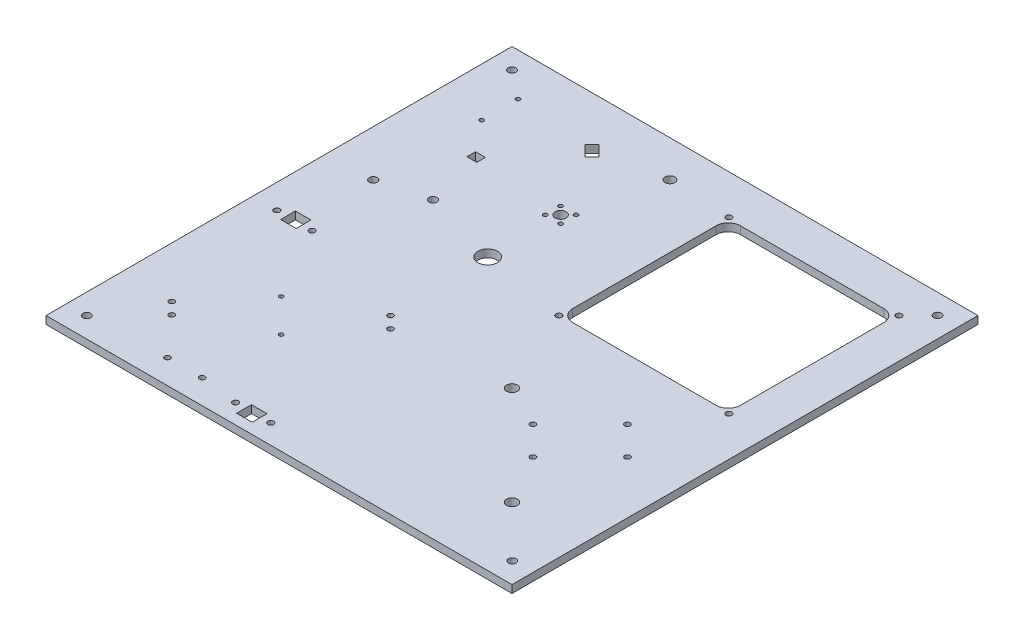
SolidWorks part; units mm, degrees
ref_plane "Front Plane" through (0, 0, 0) normal (0, 0, 1) x (1, 0, 0)
ref_plane "Top Plane" through (0, 0, 0) normal (0, 1, 0) x (1, 0, 0)
ref_plane "Right Plane" through (0, 0, 0) normal (1, 0, 0) x (0, 0, -1)
sketch "Sketch2" plane through (0, 0, 0) normal (0, 1, 0) x (1, 0, 0)
  line L1 (-191.77, -191.77) -> (191.77, -191.77)
  line L2 (-191.77, -191.77) -> (-191.77, 191.77)
  line L3 (-191.77, 191.77) -> (191.77, 191.77)
  line L4 (191.77, -191.77) -> (191.77, 191.77)
  line L5 (-191.77, -191.77) -> (191.77, 191.77) construction
  line L6 (-191.77, 191.77) -> (191.77, -191.77) construction
  point P0 (0, 0)
  dimension "D1" = 383.54
  dimension "D2" = 383.54
extrude "Boss-Extrude2" add sketch "Sketch2" along normal blind 6.35
hole_wizard "M6 Clearance Hole3" positions "Sketch3" profile "Sketch4" hole size "M6" standard "ANSI Metric"
sketch "Sketch3" plane through (0, 6.35, 0) normal (0, 1, 0) x (1, 0, 0)
  line L0 (191.77, 191.77) -> (-191.77, 191.77) construction
  line L1 (191.77, -191.77) -> (191.77, 191.77) construction
  point P0 (51.77, 151.77)
  point P2 (151.77, 151.77)
  point P4 (101.77, 101.77)
  point P6 (51.77, 51.77)
  point P8 (76.77, 76.77)
  point P10 (101.77, 51.77)
  dimension "D1" = 40
  dimension "D2" = 140
  dimension "D3" = 40
  dimension "D4" = 100
  dimension "D5" = 50
  dimension "D6" = 50
  dimension "D7" = 50
  dimension "D8" = 50
  dimension "D9" = 50
  dimension "D10" = 25
  dimension "D11" = 25
  dimension "D12" = 140
sketch "Sketch4" plane through (51.77, 6.35, -151.77) normal (1, 0, 0) x (0, 0, 1)
  line L0 (0, 0) -> (0, 6.35)
  line L1 (0, 6.35) -> (3.3, 6.35)
  line L2 (3.3, 6.35) -> (3.3, 0)
  line L5 (3.3, 0) -> (0, 0)
  line L11 (0, -6.35) -> (0, 107.95) construction
  dimension "Thru Hole Dia." = 6.6
  dimension "Thru Hole Depth" = 6.35
hole_wizard "M8 Clearance Hole2" positions "Sketch5" profile "Sketch6" hole size "M8" standard "ANSI Metric"
sketch "Sketch5" plane through (0, 6.35, 0) normal (0, 1, 0) x (1, 0, 0)
  circle A1 centre (151.77, 151.77) radius 3.3 construction
  circle A2 centre (51.77, 151.77) radius 3.3 construction
  circle A3 centre (76.77, 76.77) radius 3.3 construction
  circle A4 centre (101.77, 101.77) radius 3.3 construction
  point P0 (126.77, 126.77)
  point P2 (26.77, 126.77)
  point P4 (151.77, 101.77)
  point P6 (126.77, 26.77)
  point P8 (76.77, 26.77)
  point P10 (26.77, 76.77)
  dimension "D11" = 50
  dimension "D1" = 25
  dimension "D2" = 25
  dimension "D3" = 75
  dimension "D4" = 50
  dimension "D5" = 50
  dimension "D6" = 50
  dimension "D7" = 75
  dimension "D8" = 50
  dimension "D9" = 50
  dimension "D10" = 50
  dimension "D12" = 50
sketch "Sketch6" plane through (126.77, 6.35, -126.77) normal (1, 0, 0) x (0, 0, 1)
  line L0 (0, 0) -> (0, 6.35)
  line L1 (0, 6.35) -> (5, 6.35)
  line L2 (5, 6.35) -> (5, 0)
  line L5 (5, 0) -> (0, 0)
  line L11 (0, -6.35) -> (0, 107.95) construction
  dimension "Thru Hole Dia." = 10
  dimension "Thru Hole Depth" = 6.35
hole_wizard "1/4 (0.2500) Dowel Hole1" positions "Sketch9" profile "Sketch10" hole size "1/4" standard "ANSI Inch"
sketch "Sketch9" plane through (0, 6.35, 0) normal (0, 1, 0) x (1, 0, 0)
  line L1 (-191.77, -191.77) -> (191.77, -191.77) construction
  line L10 (191.77, -191.77) -> (191.77, 191.77) construction
  line L11 (191.77, 191.77) -> (-191.77, 191.77) construction
  point P0 (-175, -175)
  point P2 (-175, 175)
  point P4 (175, 175.23)
  point P6 (175, -174.77)
  dimension "D1" = 350
  dimension "D2" = 350
  dimension "D3" = 350
  dimension "D4" = 350
  dimension "D5" = 16.77
  dimension "D6" = 16.77
  dimension "D7" = 16.77
sketch "Sketch10" plane through (-175, 6.35, 175) normal (1, 0, 0) x (0, 0, 1)
  line L0 (0, 0) -> (0, 6.35)
  line L1 (0, 6.35) -> (3.175, 6.35)
  line L2 (3.175, 6.35) -> (3.175, 0)
  line L5 (3.175, 0) -> (0, 0)
  line L11 (0, -6.35) -> (0, 107.95) construction
  dimension "Thru Hole Dia." = 6.35
  dimension "Thru Hole Depth" = 6.35
hole_wizard "M4 Clearance Hole3" positions "Sketch11" profile "Sketch12" hole size "M4" standard "ANSI Metric"
sketch "Sketch11" plane through (0, 6.35, 0) normal (0, 1, 0) x (1, 0, 0)
  line L0 (-191.77, -191.77) -> (191.77, -191.77) construction
  line L1 (-191.77, 191.77) -> (-191.77, -191.77) construction
  point P0 (-51.77, -175.77)
  point P2 (-22.77, -175.77)
  point P24 (-171.77, -21.77)
  point P26 (-142.77, -21.77)
  dimension "D1" = 29
  dimension "D2" = 16
  dimension "D7" = 29
  dimension "D8" = 20
  dimension "D9" = 170
  dimension "D18" = 140
sketch "Sketch12" plane through (-51.77, 6.35, 175.77) normal (1, 0, 0) x (0, 0, 1)
  line L0 (0, 0) -> (0, 10.4321)
  line L1 (0, 10.4321) -> (2.4, 8.99)
  line L2 (2.4, 8.99) -> (2.4, 0)
  line L5 (2.4, 0) -> (0, 0)
  line L10 (0, 10.4321) -> (-2.4, 8.99) construction
  line L11 (0, -6.35) -> (0, 107.95) construction
  dimension "Hole Dia." = 4.8
  dimension "Hole Depth" = 8.99
  dimension "Drill Angle" = 118
hole_wizard "M8 Clearance Hole1" positions "Sketch15" profile "Sketch16" hole size "M8" standard "ANSI Metric"
sketch "Sketch15" plane through (0, 6.35, 0) normal (0, 1, 0) x (1, 0, 0)
  line L0 (191.77, -191.77) -> (191.77, 191.77) construction
  line L1 (-191.77, -191.77) -> (191.77, -191.77) construction
  line L4 (133.0873, -133.0873) -> (51.77, -51.77) construction
  line L6 (-191.77, -191.77) -> (191.77, -191.77) construction
  point P0 (51.77, -51.77)
  point P9 (133.0873, -133.0873)
  dimension "D1" = 140
  dimension "D2" = 140
  dimension "D3" = 115
  dimension "D4" = 45
sketch "Sketch16" plane through (51.77, 6.35, 51.77) normal (1, 0, 0) x (0, 0, 1)
  line L0 (0, 0) -> (0, 11.6939)
  line L1 (0, 11.6939) -> (4.5, 8.99)
  line L2 (4.5, 8.99) -> (4.5, 0)
  line L5 (4.5, 0) -> (0, 0)
  line L10 (0, 11.6939) -> (-4.5, 8.99) construction
  line L11 (0, -6.35) -> (0, 107.95) construction
  dimension "Hole Dia." = 9
  dimension "Hole Depth" = 8.99
  dimension "Drill Angle" = 118
hole_wizard "M3 Clearance Hole1" positions "Sketch17" profile "Sketch18" hole size "M3" standard "ANSI Metric"
sketch "Sketch17" plane through (0, 6.35, 0) normal (0, 1, 0) x (1, 0, 0)
  line L0 (-191.77, 191.77) -> (-191.77, -191.77) construction
  line L1 (191.77, 191.77) -> (-191.77, 191.77) construction
  point P0 (-151.77, 156.77)
  point P2 (-151.77, 126.77)
  point P4 (-58.09, 85.44)
  point P6 (-45.44, 85.44)
  point P8 (-45.44, 98.09)
  point P10 (-58.09, 98.09)
  dimension "D1" = 30
  dimension "D2" = 12.65
  dimension "D3" = 12.65
  dimension "D4" = 12.65
  dimension "D5" = 12.65
  dimension "D6" = 17.8898
  dimension "D7" = 40
  dimension "D8" = 35
  dimension "D9" = 40
  dimension "D10" = 133.68
  dimension "D11" = 93.68
sketch "Sketch18" plane through (-151.77, 6.35, -156.77) normal (1, 0, 0) x (0, 0, 1)
  line L0 (0, 0) -> (0, 10.0115)
  line L1 (0, 10.0115) -> (1.7, 8.99)
  line L2 (1.7, 8.99) -> (1.7, 0)
  line L5 (1.7, 0) -> (0, 0)
  line L10 (0, 10.0115) -> (-1.7, 8.99) construction
  line L11 (0, -6.35) -> (0, 107.95) construction
  dimension "Hole Dia." = 3.4
  dimension "Hole Depth" = 8.99
  dimension "Drill Angle" = 118
sketch "Sketch19" plane through (0, 6.35, 0) normal (0, 1, 0) x (1, 0, 0)
  line L0 (-91.77, 151.77) -> (-83.1857, 143.1857)
  line L1 (-83.1857, 143.1857) -> (-77.444, 148.9274)
  line L2 (-77.444, 148.9274) -> (-86.0283, 157.5117)
  line L3 (-86.0283, 157.5117) -> (-91.77, 151.77)
  line L4 (-131.77, 101.77) -> (-131.77, 94.65)
  line L5 (-131.77, 94.65) -> (-123.65, 94.65)
  line L6 (-123.65, 94.65) -> (-123.65, 101.77)
  line L7 (-123.65, 101.77) -> (-131.77, 101.77)
  line L8 (191.77, 191.77) -> (-191.77, 191.77) construction
  line L9 (-191.77, 191.77) -> (-191.77, -191.77) construction
  line L10 (191.77, 191.77) -> (-191.77, 191.77) construction
  circle A0 centre (-51.77, 31.77) radius 8.1
  circle A1 centre (-31.77, 161.77) radius 4.06
  circle A2 centre (-51.77, 91.77) radius 4.5
  dimension "D1" = 7.12
  dimension "D13" = 100
  dimension "D2" = 8.12
  dimension "D3" = 8.12
  dimension "D4" = 12.14
  dimension "D5" = 40
  dimension "D6" = 100
  dimension "D7" = 90
  dimension "D8" = 60
  dimension "D9" = 140
  dimension "D10" = 160
  dimension "D11" = 30
  dimension "D12" = 160
  dimension "D14" = 140
  dimension "D15" = 45
extrude "Cut-Extrude1" cut sketch "Sketch19" against normal through all
sketch "Sketch20" plane through (0, 6.35, 0) normal (0, 1, 0) x (1, 0, 0)
  circle A0 centre (151.77, 151.77) radius 3.3 construction
  point P0 (159.27, 159.27)
  point P1 (159.27, 19.27)
  point P2 (19.27, 19.27)
  point P3 (19.27, 159.27)
  dimension "D3" = 140
  dimension "D1" = 7.5
  dimension "D2" = 7.5
  dimension "D4" = 140
hole_wizard "M4 Clearance Hole1" positions "Sketch21" profile "Sketch22" hole size "M4" standard "ANSI Metric"
sketch "Sketch21" plane through (0, 6.35, 0) normal (0, 1, 0) x (1, 0, 0)
  line L0 (159.27, 159.27) -> (19.27, 19.27) construction
  line L2 (19.27, 159.27) -> (159.27, 19.27) construction
  point P18 (159.27, 19.27)
  point P20 (19.27, 19.27)
  point P22 (19.27, 159.27)
  point P24 (159.27, 159.27)
  point P36 (89.27, 89.27)
  point P39 (89.27, 89.27)
  dimension "D3" = 140
  dimension "D4" = 140
  dimension "D5" = 140
  dimension "D6" = 140
sketch "Sketch22" plane through (159.27, 6.35, -19.27) normal (1, 0, 0) x (0, 0, 1)
  line L0 (0, 0) -> (0, 6.35)
  line L1 (0, 6.35) -> (2.4, 6.35)
  line L2 (2.4, 6.35) -> (2.4, 0)
  line L5 (2.4, 0) -> (0, 0)
  line L11 (0, -6.35) -> (0, 107.95) construction
  dimension "Thru Hole Dia." = 4.8
  dimension "Thru Hole Depth" = 6.35
sketch "Sketch23" plane through (0, 6.35, 0) normal (0, 1, 0) x (1, 0, 0)
  line L1 (30, 20) -> (148, 20)
  line L2 (20, 30) -> (20, 148)
  line L3 (30, 158) -> (148, 158)
  line L4 (158, 30) -> (158, 148)
  line L6 (-55, 0) -> (55, 0) construction
  line L8 (0, -55) -> (0, 55) construction
  arc A0 (20, 148) -> (30, 158) centre (30, 148) cw
  arc A1 (30, 20) -> (20, 30) centre (30, 30) cw
  arc A2 (158, 30) -> (148, 20) centre (148, 30) cw
  arc A3 (148, 158) -> (158, 148) centre (148, 148) cw
  point P10 (20, 158)
  point P15 (158, 20)
  point P18 (158, 158)
  dimension "D5" = 10
  dimension "D6" = 10
  dimension "D7" = 10
  dimension "D8" = 10
  dimension "D1" = 138
  dimension "D2" = 138
  dimension "D3" = 20
  dimension "D4" = 20
extrude "Cut-Extrude2" cut sketch "Sketch23" against normal through all
sketch "Sketch24" plane through (0, 0, 0) normal (0, -1, 0) x (1, 0, 0)
  line L0 (148.3345, 53.3345) -> (125, 30) construction
  line L1 (125, 30) -> (86.1091, 68.8909) construction
  line L2 (86.1091, 68.8909) -> (109.4437, 92.2254) construction
  line L3 (109.4437, 92.2254) -> (148.3345, 53.3345) construction
  line L4 (0, 0) -> (191.77, 0) construction
  line L5 (191.77, 191.77) -> (191.77, -191.77) construction
  point P0 (148.3345, 53.3345)
  point P1 (125, 30)
  point P2 (109.4437, 92.2254)
  point P3 (86.1091, 68.8909)
  dimension "D1" = 33
  dimension "D2" = 55
  dimension "D3" = 30
  dimension "D4" = 45
  dimension "D5" = 125
hole_wizard "M4 Clearance Hole2" positions "Sketch25" profile "Sketch26" hole size "M4" standard "ANSI Metric"
sketch "Sketch25" plane through (0, 0, 0) normal (0, -1, 0) x (-1, 0, 0)
  point P0 (-148.3345, -53.3345)
  point P3 (-125, -30)
  point P6 (-109.4437, -92.2254)
  point P9 (-86.1091, -68.8909)
sketch "Sketch26" plane through (148.3345, 0, 53.3345) normal (1, 0, 0) x (0, 0, -1)
  line L0 (0, 0) -> (0, 10.3419)
  line L1 (0, 10.3419) -> (2.25, 8.99)
  line L2 (2.25, 8.99) -> (2.25, 0)
  line L5 (2.25, 0) -> (0, 0)
  line L10 (0, 10.3419) -> (-2.25, 8.99) construction
  line L11 (0, -6.35) -> (0, 107.95) construction
  dimension "Hole Dia." = 4.5
  dimension "Hole Depth" = 8.99
  dimension "Drill Angle" = 118
hole_wizard "M6 Clearance Hole5" positions "Sketch27" profile "Sketch28" hole size "M6" standard "ANSI Metric"
sketch "Sketch27" plane through (0, 6.35, 0) normal (0, 1, 0) x (1, 0, 0)
  line L0 (-153.8302, 39.5955) -> (-115, 50) construction
  line L1 (191.77, 191.77) -> (-191.77, 191.77) construction
  point P0 (-115, 50)
  point P2 (-153.8302, 39.5955)
  dimension "D1" = 115
  dimension "D2" = 40.2
  dimension "D3" = 50
  dimension "D4" = 15
sketch "Sketch28" plane through (-115, 6.35, -50) normal (1, 0, 0) x (0, 0, 1)
  line L0 (0, 0) -> (0, 10.9728)
  line L1 (0, 10.9728) -> (3.3, 8.99)
  line L2 (3.3, 8.99) -> (3.3, 0)
  line L5 (3.3, 0) -> (0, 0)
  line L10 (0, 10.9728) -> (-3.3, 8.99) construction
  line L11 (0, -6.35) -> (0, 107.95) construction
  dimension "Hole Dia." = 6.6
  dimension "Hole Depth" = 8.99
  dimension "Drill Angle" = 118
sketch "Sketch29" plane through (0, 6.35, 0) normal (0, 1, 0) x (1, 0, 0)
  line L0 (-51.77, -175.77) -> (-22.77, -175.77) construction
  line L1 (-43.67, -182.97) -> (-30.87, -182.97)
  line L2 (-43.67, -182.97) -> (-43.67, -170.77)
  line L3 (-43.67, -170.77) -> (-30.87, -170.77)
  line L4 (-30.87, -182.97) -> (-30.87, -170.77)
  line L5 (-43.67, -182.97) -> (-30.87, -170.77) construction
  line L6 (-43.67, -170.77) -> (-30.87, -182.97) construction
  line L7 (-171.77, -21.77) -> (-142.77, -21.77) construction
  line L8 (-163.67, -26.77) -> (-150.87, -26.77)
  line L9 (-163.67, -26.77) -> (-163.67, -14.57)
  line L10 (-163.67, -14.57) -> (-150.87, -14.57)
  line L11 (-150.87, -26.77) -> (-150.87, -14.57)
  line L12 (-163.67, -26.77) -> (-150.87, -14.57) construction
  line L13 (-163.67, -14.57) -> (-150.87, -26.77) construction
  point P0 (-37.27, -176.87)
  point P10 (-157.27, -20.67)
  point P17 (-157.27, -21.77)
  point P26 (-37.27, -175.77)
  dimension "D1" = 12.8
  dimension "D2" = 12.2
  dimension "D3" = 12.8
  dimension "D4" = 12.2
  dimension "D5" = 1.1
  dimension "D6" = 1.1
extrude "Cut-Extrude3" cut sketch "Sketch29" against normal blind 10
hole_wizard "M4 Clearance Hole4" positions "Sketch30" profile "Sketch31" hole size "M4" standard "ANSI Metric"
sketch "Sketch30" plane through (0, 6.35, 0) normal (0, 1, 0) x (1, 0, 0)
  line L0 (-150, -130) -> (-140.4541, -139.5459) construction
  line L2 (-50, -50) -> (-40.4541, -59.5459) construction
  line L4 (-55, 0) -> (55, 0) construction
  line L5 (0, -55) -> (0, 55) construction
  point P0 (-40.4541, -59.5459)
  point P2 (-50, -50)
  point P4 (-140.4541, -139.5459)
  point P6 (-150, -130)
  dimension "D1" = 13.5
  dimension "D2" = 13.5
  dimension "D3" = 45
  dimension "D4" = 45
  dimension "D5" = 50
  dimension "D6" = 50
  dimension "D7" = 130
  dimension "D8" = 150
sketch "Sketch31" plane through (-40.4541, 6.35, 59.5459) normal (1, 0, 0) x (0, 0, 1)
  line L0 (0, 0) -> (0, 14.0519)
  line L1 (0, 14.0519) -> (2.25, 12.7)
  line L2 (2.25, 12.7) -> (2.25, 0)
  line L5 (2.25, 0) -> (0, 0)
  line L10 (0, 14.0519) -> (-2.25, 12.7) construction
  line L11 (0, -6.35) -> (0, 107.95) construction
  dimension "Hole Dia." = 4.5
  dimension "Hole Depth" = 12.7
  dimension "Drill Angle" = 118
hole_wizard "M3 Clearance Hole2" positions "Sketch32" profile "Sketch33" hole size "M3" standard "ANSI Metric"
sketch "Sketch32" plane through (0, 6.35, 0) normal (0, 1, 0) x (1, 0, 0)
  line L0 (-108.6118, -81.3882) -> (-81.3882, -108.6118) construction
  line L2 (-55, 0) -> (55, 0) construction
  line L3 (0, -55) -> (0, 55) construction
  point P0 (-108.6118, -81.3882)
  point P2 (-81.3882, -108.6118)
  point P11 (-95, -95)
  dimension "D1" = 38.5
  dimension "D2" = 45
  dimension "D3" = 95
  dimension "D4" = 95
sketch "Sketch33" plane through (-108.6118, 6.35, 81.3882) normal (1, 0, 0) x (0, 0, 1)
  line L0 (0, 0) -> (0, 13.7215)
  line L1 (0, 13.7215) -> (1.7, 12.7)
  line L2 (1.7, 12.7) -> (1.7, 0)
  line L5 (1.7, 0) -> (0, 0)
  line L10 (0, 13.7215) -> (-1.7, 12.7) construction
  line L11 (0, -6.35) -> (0, 107.95) construction
  dimension "Hole Dia." = 3.4
  dimension "Hole Depth" = 12.7
  dimension "Drill Angle" = 118
hole_wizard "M4 Clearance Hole5" positions "Sketch34" profile "Sketch35" hole size "M4" standard "ANSI Metric"
sketch "Sketch34" plane through (0, 0, 0) normal (0, -1, 0) x (-1, 0, 0)
  line L0 (191.77, -191.77) -> (-191.77, -191.77) construction
  line L1 (191.77, 191.77) -> (191.77, -191.77) construction
  point P0 (83.27, -171.77)
  point P2 (111.77, -171.77)
  dimension "D1" = 28.5
  dimension "D2" = 20
  dimension "D3" = 80
sketch "Sketch35" plane through (-83.27, 0, 171.77) normal (1, 0, 0) x (0, 0, -1)
  line L0 (0, 0) -> (0, 10.3419)
  line L1 (0, 10.3419) -> (2.25, 8.99)
  line L2 (2.25, 8.99) -> (2.25, 0)
  line L5 (2.25, 0) -> (0, 0)
  line L10 (0, 10.3419) -> (-2.25, 8.99) construction
  line L11 (0, -6.35) -> (0, 107.95) construction
  dimension "Hole Dia." = 4.5
  dimension "Hole Depth" = 8.99
  dimension "Drill Angle" = 118
